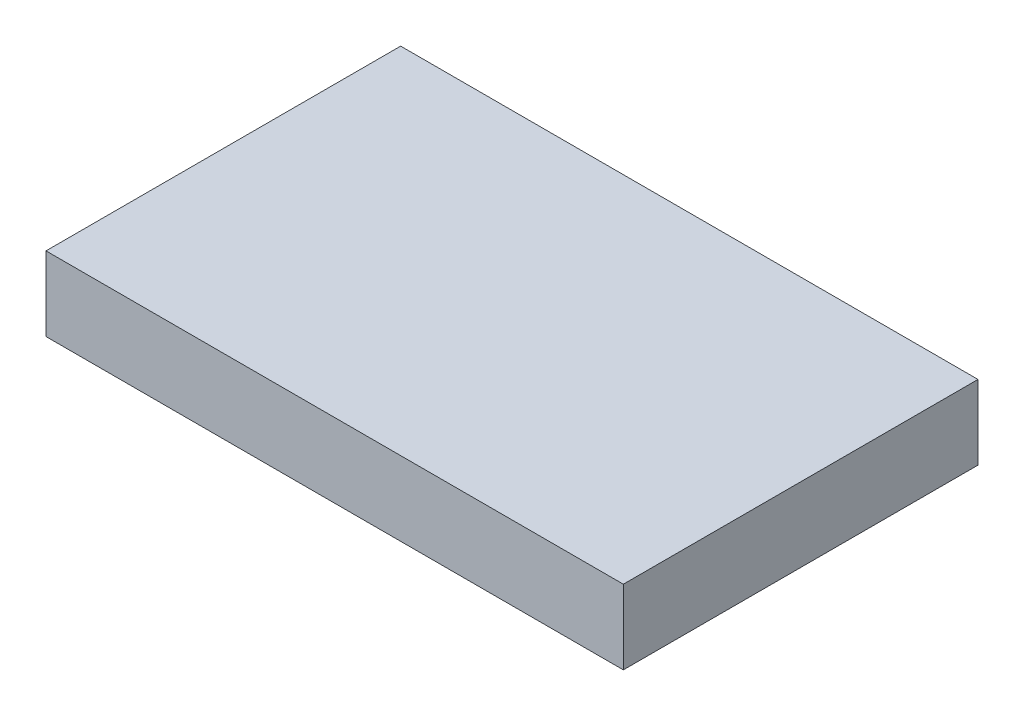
SolidWorks part; units mm, degrees
ref_plane "Front" through (0, 0, 0) normal (0, 0, 1) x (1, 0, 0)
ref_plane "Top" through (0, 0, 0) normal (0, 1, 0) x (1, 0, 0)
ref_plane "Right" through (0, 0, 0) normal (1, 0, 0) x (0, 0, -1)
sketch "Sketch1" plane through (0, 0, 0) normal (0, 0, 1) x (1, 0, 0)
  line L0 (0, 18) -> (0, 56)
  line L1 (0, 0) -> (140, 0)
  line L2 (0, 0) -> (0, 18)
  line L3 (0, 18) -> (140, 18)
  line L4 (140, 0) -> (140, 18)
  line L5 (140, 18) -> (114.2945, 123.8972)
  line L6 (20, 76) -> (40, 76)
  line L7 (65, 118) -> (65, 101)
  circle A0 centre (20, 56) radius 20
  circle A1 centre (20, 56) radius 10
  circle A2 centre (90, 118) radius 25
  circle A3 centre (90, 118) radius 15
  arc A4 (65, 101) -> (40, 76) centre (40, 101) cw
  dimension "D1" = 25
  dimension "D7" = 50
  dimension "D8" = 30
  dimension "D9" = 40
  dimension "D10" = 20
  dimension "D2" = 38
  dimension "D3" = 18
  dimension "D4" = 20
  dimension "D5" = 100
  dimension "D6" = 50
  dimension "D11" = 140
extrude "Extrude1" add sketch "Sketch1" along normal blind 86 contours L1 L4 L3 L2
